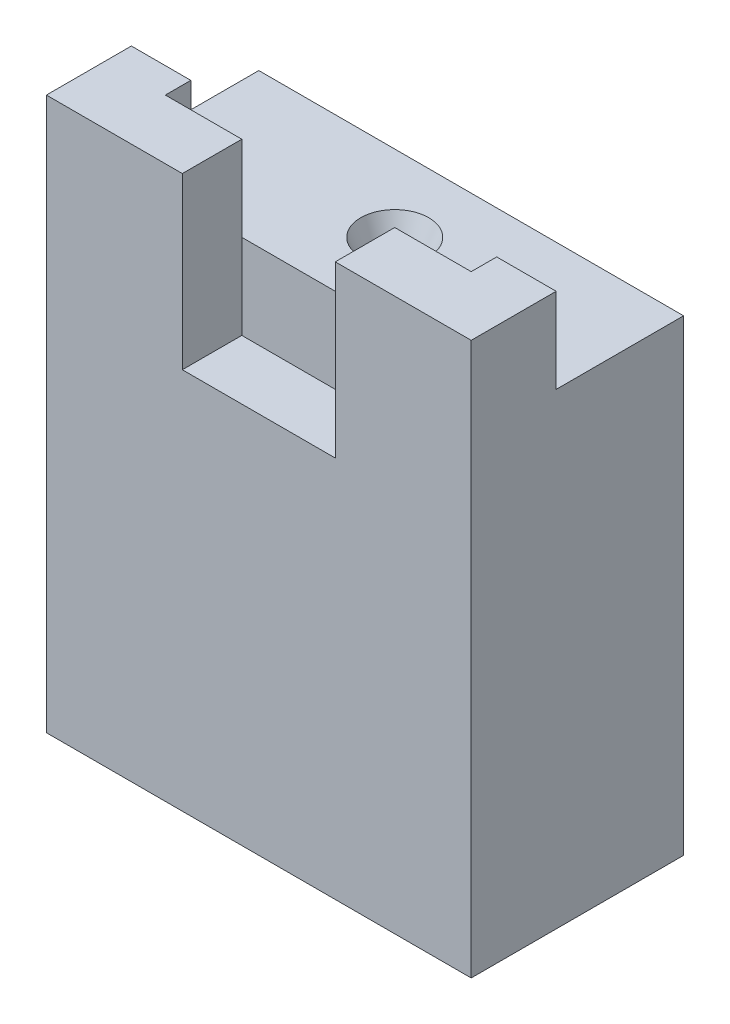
SolidWorks part; units mm, degrees
ref_plane "前视基准面" through (0, 0, 0) normal (0, 0, 1) x (1, 0, 0)
ref_plane "上视基准面" through (0, 0, 0) normal (0, 1, 0) x (1, 0, 0)
ref_plane "右视基准面" through (0, 0, 0) normal (1, 0, 0) x (0, 0, -1)
sketch "草图1" plane through (0, 0, 0) normal (0, 1, 0) x (1, 0, 0)
  line L0 (0, 0) -> (80.8939, 0) construction
  line L1 (80.8939, 0) -> (0, 0) construction
  line L2 (0, 0) -> (0, 69.8629) construction
  line L4 (-25, 12.5) -> (25, 12.5)
  line L5 (-25, 12.5) -> (-25, -12.5)
  line L6 (-25, -12.5) -> (25, -12.5)
  line L7 (25, 12.5) -> (25, -12.5)
extrude "拉伸1" add sketch "草图1" along normal blind 55
sketch "草图3" plane through (0, 55, 0) normal (0, 1, 0) x (1, 0, 0)
  line L0 (0, 0) -> (0, -17.4808) construction
  line L1 (-25, -12.5) -> (25, -12.5) construction
  line L2 (-9, -5.5) -> (9, -5.5)
  line L3 (-9, -5.5) -> (-9, -12.5)
  line L4 (-9, -12.5) -> (9, -12.5)
  line L5 (9, -5.5) -> (9, -12.5)
extrude "切除-拉伸2" cut sketch "草图3" against normal blind 10
sketch "草图4" plane through (0, 55, 0) normal (0, 1, 0) x (1, 0, 0)
  line L0 (-9, -5.5) -> (-18, -5.5)
  line L2 (-18, -5.5) -> (-18, -2.5)
  line L3 (-18, -2.5) -> (-25, -2.5)
  line L4 (-25, 12.5) -> (-25, -12.5) construction
  line L5 (-25, -2.5) -> (-25, -12.5)
  line L6 (-25, -12.5) -> (-9, -12.5)
  line L7 (-9, -12.5) -> (-9, -5.5)
  line L8 (0, 0) -> (0, -17.9598) construction
  line L9 (9, -12.5) -> (9, -5.5)
  line L10 (25, -12.5) -> (9, -12.5)
  line L11 (25, -2.5) -> (25, -12.5)
  line L12 (18, -2.5) -> (25, -2.5)
  line L13 (18, -5.5) -> (18, -2.5)
  line L14 (9, -5.5) -> (18, -5.5)
sketch "草图5" plane through (0, 0, 0) normal (1, 0, 0) x (0, 0, -1)
  line L0 (3.5, 4.0927) -> (3.5, 59.0885) construction
  line L1 (-12.5, 25) -> (-12.5, 45) construction
  line L2 (3.5, 55) -> (-0.5, 55)
  line L3 (-12.5, 55) -> (12.5, 55) construction
  line L4 (-0.5, 55) -> (3.5, 45.5594)
  line L5 (3.5, 45.5594) -> (3.5, 55)
  dimension "D1" = 16
revolve "切除-旋转1" cut sketch "草图5" angle 360 about L0
extrude "拉伸2" add sketch "草图4" along normal blind 10
